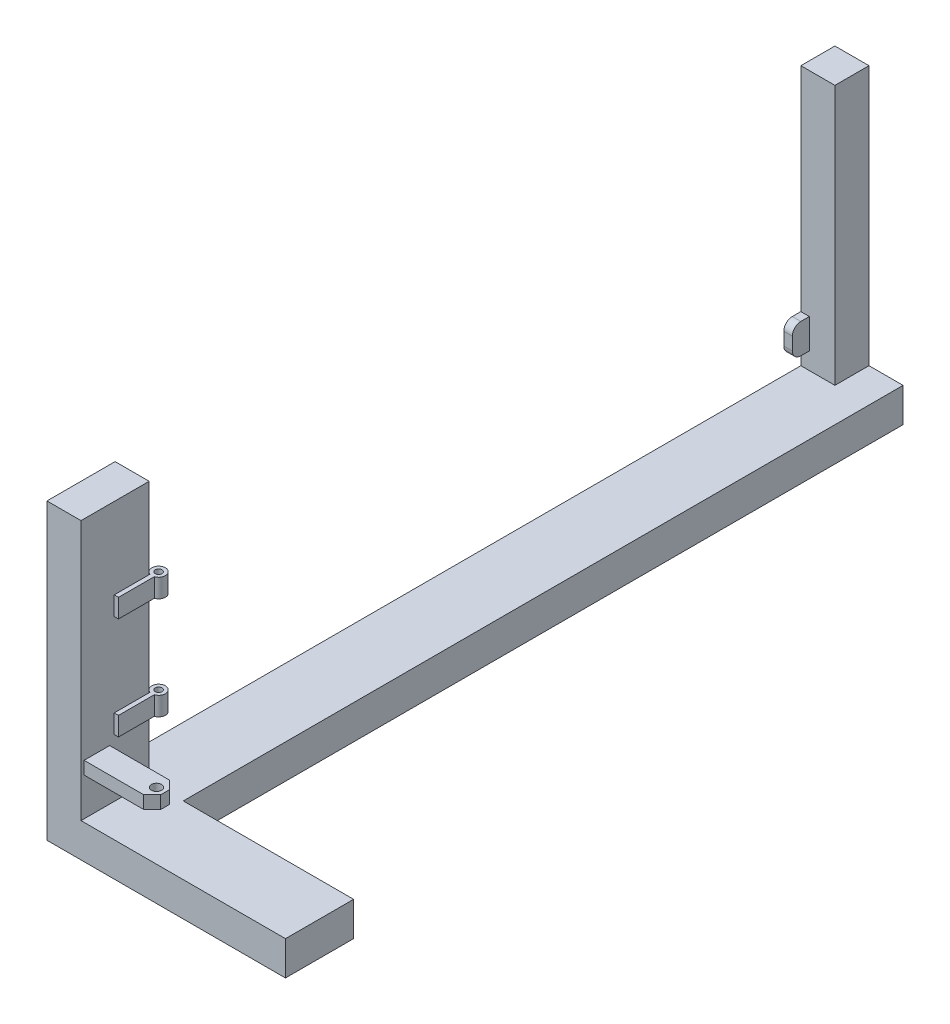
SolidWorks part; units mm, degrees
ref_plane "Plan1" through (0, 0, 0) normal (0, 0, 1) x (1, 0, 0)
ref_plane "Plan2" through (0, 0, 0) normal (0, 1, 0) x (1, 0, 0)
ref_plane "Plan3" through (0, 0, 0) normal (1, 0, 0) x (0, 0, -1)
sketch "Esquisse1" plane through (0, 0, 0) normal (0, 0, 1) x (1, 0, 0)
  line L1 (0, 0) -> (80, 0)
  line L2 (0, 0) -> (0, 40)
  line L3 (0, 40) -> (80, 40)
  line L4 (80, 0) -> (80, 40)
  dimension "D1" = 80
  dimension "D2" = 40
extrude "Base-Extrusion" add sketch "Esquisse1" along normal blind 925
sketch "Esquisse2" plane through (80, 0, 0) normal (1, 0, 0) x (0, 0, -1)
  line L0 (-925, 0) -> (0, 0) construction
  line L1 (-925, 40) -> (-845, 40)
  line L2 (-925, 40) -> (-925, 0)
  line L3 (-925, 0) -> (-845, 0)
  line L4 (-845, 40) -> (-845, 0)
  dimension "D1" = 80
extrude "Boss.-Extru.1" add sketch "Esquisse2" along normal blind 200
sketch "Esquisse3" plane through (0, 40, 0) normal (0, 1, 0) x (-1, 0, 0)
  line L0 (-280, 925) -> (0, 925) construction
  line L1 (0, 925) -> (-40, 925)
  line L2 (0, 925) -> (0, 845)
  line L3 (0, 845) -> (-40, 845)
  line L4 (-40, 925) -> (-40, 845)
  line L6 (0, 925) -> (0, 0) construction
  dimension "D1" = 40
  dimension "D2" = 80
extrude "Boss.-Extru.2" add sketch "Esquisse3" along normal blind 305
sketch "Esquisse4" plane through (0, 40, 0) normal (0, 1, 0) x (-1, 0, 0)
  line L1 (0, 0) -> (-40, 0)
  line L2 (0, 0) -> (0, 40)
  line L3 (0, 40) -> (-40, 40)
  line L4 (-40, 0) -> (-40, 40)
  dimension "D1" = 40
  dimension "D2" = 40
extrude "Boss.-Extru.3" add sketch "Esquisse4" along normal blind 305
sketch "Esquisse5" plane through (40, 0, 0) normal (1, 0, 0) x (0, 0, -1)
  line L0 (-886, 130) -> (-844, 130)
  line L1 (-886, 250) -> (-844, 250)
  line L2 (-886, 250) -> (-886, 228)
  line L3 (-886, 228) -> (-844, 228)
  line L4 (-844, 250) -> (-844, 228)
  line L5 (-886, 130) -> (-886, 108)
  line L6 (-886, 108) -> (-844, 108)
  line L7 (-844, 130) -> (-844, 108)
  line L9 (-845, 345) -> (-845, 40) construction
  line L10 (-845, 40) -> (0, 40) construction
  dimension "D1" = 90
  dimension "D2" = 22
  dimension "D3" = 120
  dimension "D4" = 42
  dimension "D5" = 1
extrude "Boss.-Extru.4" add sketch "Esquisse5" along normal blind 5
sketch "Esquisse6" plane through (0, 250, 0) normal (0, 1, 0) x (-1, 0, 0)
  line L0 (-42.5, 886) -> (-42.5, 776.1639) construction
  line L1 (-45, 886) -> (-40, 886) construction
  circle A0 centre (-42.5, 836.4007) radius 8
  circle A1 centre (-42.5, 836.4007) radius 4
  dimension "D1" = 16
  dimension "D2" = 8
extrude "Boss.-Extru.5" add sketch "Esquisse6" against normal blind 22
sketch "Esquisse8" plane through (0, 130, 0) normal (0, 1, 0) x (-1, 0, 0)
  circle A0 centre (-42.5, 836.4007) radius 4
  circle A1 centre (-42.5, 836.4007) radius 8
extrude "Boss.-Extru.7" add sketch "Esquisse8" against normal blind 22
sketch "Esquisse9" plane through (0, 0, 40) normal (0, 0, 1) x (1, 0, 0)
  line L0 (0, 345) -> (0, 0) construction
  line L1 (0, 60) -> (10, 60)
  line L2 (0, 60) -> (0, 95)
  line L3 (0, 95) -> (10, 95)
  line L4 (10, 60) -> (10, 95)
  line L5 (40, 40) -> (0, 40) construction
  dimension "D1" = 35
  dimension "D2" = 10
  dimension "D3" = 20
extrude "Boss.-Extru.8" add sketch "Esquisse9" along normal blind 20
fillet "Congé1" radius 10 2 edges at (5, 60, 60) (5, 95, 60)
sketch "Esquisse10" plane through (40, 0, 0) normal (1, 0, 0) x (0, 0, -1)
  line L0 (-906.4007, 126) -> (-906.4007, 43) construction
  line L1 (-836.4007, 108) -> (-836.4007, 130) construction
  line L2 (-891.4007, 99.5) -> (-891.4007, 84.5)
  line L3 (-921.4007, 99.5) -> (-891.4007, 99.5)
  line L4 (-921.4007, 99.5) -> (-921.4007, 84.5)
  line L5 (-921.4007, 84.5) -> (-891.4007, 84.5)
  line L6 (-845, 40) -> (0, 40) construction
  point P9 (-906.4007, 84.5)
  point P10 (-906.4007, 99.5)
  dimension "D1" = 70
  dimension "D2" = 30
  dimension "D3" = 15
  dimension "D4" = 44.5
extrude "Boss.-Extru.9" add sketch "Esquisse10" along normal blind 80
sketch "Esquisse11" plane through (0, 99.5, 0) normal (0, 1, 0) x (-1, 0, 0)
  line L0 (-120, 906.4007) -> (-74.742, 906.4007) construction
  line L1 (-120, 891.4007) -> (-120, 921.4007) construction
  line L2 (-40, 925) -> (-40, 845) construction
  circle A0 centre (-110, 906.4007) radius 6
  dimension "D1" = 12
  dimension "D2" = 70
extrude "Enlèv. mat.-Extru.1" cut sketch "Esquisse11" against normal up to next
chamfer "Chanfrein1" distance 10 angle 45 2 edges at (120, 92, 921.4007) (120, 92, 891.4007)
sketch "Esq_WRNL_Compact001" plane through (0, 0, 0) normal (0, 0, 1) x (1, 0, 0)
  line L0 (-1, -1) -> (-1, 346)
  line L1 (281, -1) -> (281, 346)
  line L2 (-1, -1) -> (281, -1)
  line L3 (-1, 346) -> (281, 346)
ref_plane "Plan4" through (0, 92, 0) normal (0, 1, 0) x (-1, 0, 0)
sketch "POINT ENCRAGE BATI" plane through (0, 92, 0) normal (0, 1, 0) x (-1, 0, 0)
  point P0 (-110, 906.4007)
  point P1 (-672.545, 493.0281)
sketch "POINT ROTULE" plane through (0, 130, 0) normal (0, 1, 0) x (1, 0, 0)
  point P0 (42.5, -836.4007)
